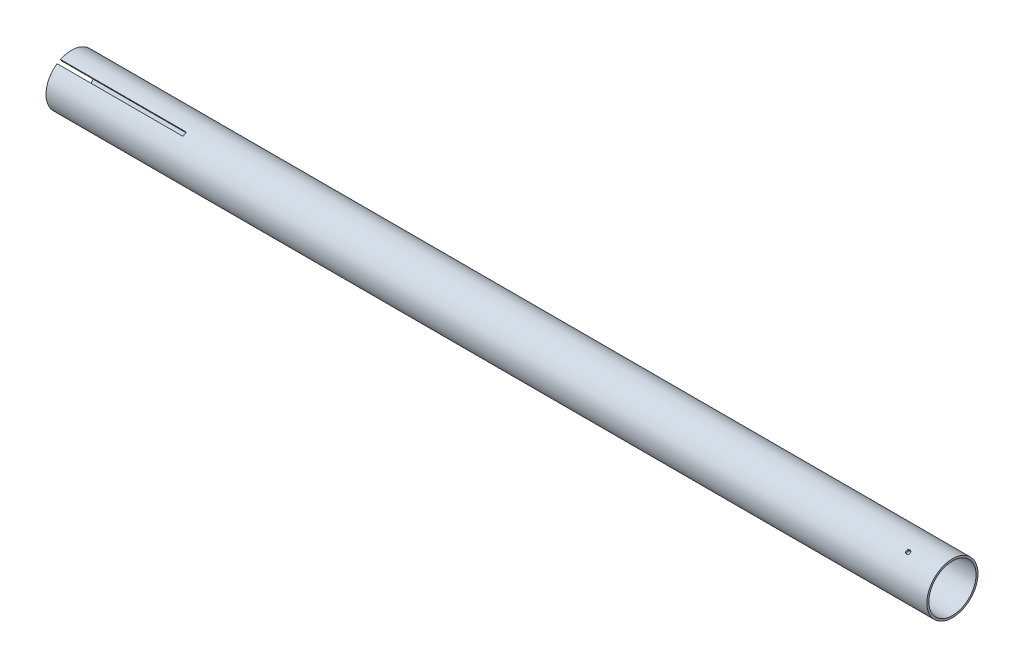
SolidWorks part; units mm, degrees
ref_plane "Front Plane" through (0, 0, 0) normal (0, 0, 1) x (1, 0, 0)
ref_plane "Top Plane" through (0, 0, 0) normal (0, 1, 0) x (1, 0, 0)
ref_plane "Right Plane" through (0, 0, 0) normal (1, 0, 0) x (0, 0, -1)
sketch "Sketch1" plane through (0, 0, 0) normal (1, 0, 0) x (0, 0, -1)
  circle A0 centre (0, 0) radius 20.6375
  circle A1 centre (0, 0) radius 19.05
  dimension "D1" = 41.275
  dimension "D2" = 38.1
extrude "Extrude1" add sketch "Sketch1" along normal blind 711.2
sketch "Sketch2" plane through (0, 0, 0) normal (0, 0, 1) x (1, 0, 0)
  line L0 (0, 0) -> (711.2, 0) construction
  line L1 (0, 20.6375) -> (0, -20.6375) construction
  line L2 (711.2, -20.6375) -> (711.2, 20.6375) construction
ref_plane "Plane1" through (0, 0, 0) normal (0, -0.866, -0.5) x (1, 0, 0)
ref_plane "Plane2" through (0, 0, 0) normal (0, 0.866, -0.5) x (-1, 0, 0)
sketch "Sketch3" plane through (0, 0, 0) normal (0, 0, 1) x (1, 0, 0)
  line L0 (0, 0) -> (711.2, 0) construction
  line L1 (711.2, -20.6375) -> (711.2, 20.6375) construction
  circle A0 centre (685.8, 0) radius 1.5875
  dimension "D2" = 3.175
  dimension "D1" = 25.4
extrude "Cut-Extrude1" cut sketch "Sketch3" against normal through all
sketch "Sketch4" plane through (0, 0, 0) normal (0, -0.866, -0.5) x (1, 0, 0)
  line L0 (0, 0) -> (711.2, 0) construction
  line L1 (711.2, -20.6375) -> (711.2, 20.6375) construction
  circle A0 centre (685.8, 0) radius 1.5875
  dimension "D1" = 3.175
  dimension "D2" = 25.4
extrude "Cut-Extrude2" cut sketch "Sketch4" against normal through all
sketch "Sketch5" plane through (0, 0, 0) normal (0, 0.866, -0.5) x (-1, 0, 0)
  line L0 (0, 0) -> (-711.2, 0) construction
  line L1 (-711.2, 20.6375) -> (-711.2, -20.6375) construction
  circle A0 centre (-685.8, 0) radius 1.5875
  dimension "D2" = 3.175
  dimension "D1" = 25.4
extrude "Cut-Extrude3" cut sketch "Sketch5" against normal through all
sketch "Sketch6" plane through (0, 0, 0) normal (0, 0, 1) x (1, 0, 0)
  line L0 (0, 20.6375) -> (0, -20.6375) construction
  line L1 (0, 1.5875) -> (101.6, 1.5875)
  line L2 (101.6, 1.5875) -> (101.6, -1.5875)
  line L3 (101.6, -1.5875) -> (0, -1.5875)
  line L4 (0, 1.5875) -> (0, -1.5875)
  dimension "D1" = 3.175
  dimension "D2" = 1.5875
  dimension "D3" = 101.6
extrude "Cut-Extrude4" cut sketch "Sketch6" against normal through all
sketch "Sketch7" plane through (0, 0, 0) normal (0, -0.866, -0.5) x (1, 0, 0)
  line L0 (0, 1.5875) -> (101.6, 1.5875)
  line L1 (0, 20.6375) -> (0, -20.6375) construction
  line L2 (101.6, 1.5875) -> (101.6, -1.5875)
  line L3 (101.6, -1.5875) -> (0, -1.5875)
  line L4 (0, -1.5875) -> (0, 1.5875)
  dimension "D1" = 3.175
  dimension "D2" = 1.5875
  dimension "D3" = 101.6
extrude "Cut-Extrude5" cut sketch "Sketch7" against normal through all
sketch "Sketch8" plane through (0, 0, 0) normal (0, 0.866, -0.5) x (-1, 0, 0)
  line L0 (0, 1.5875) -> (-101.6, 1.5875)
  line L3 (-101.6, -1.5875) -> (-101.6, 1.5875)
  line L4 (-101.6, -1.5875) -> (0, -1.5875)
  line L5 (0, 1.5875) -> (0, -1.5875)
  dimension "D1" = 101.6
  dimension "D2" = 3.175
  dimension "D3" = 1.5875
extrude "Cut-Extrude6" cut sketch "Sketch8" against normal through all
